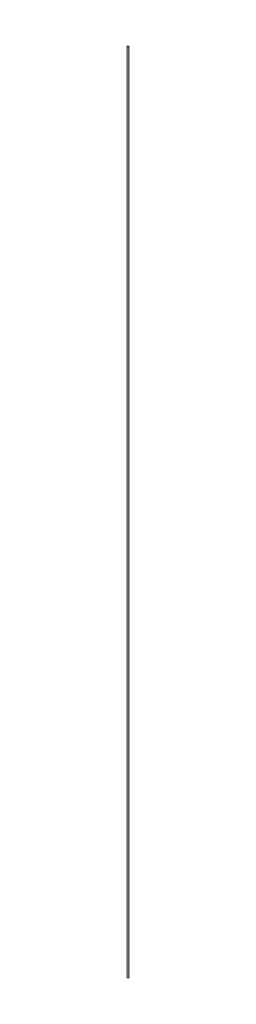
SolidWorks part; units mm, degrees
ref_plane "Plan de face" through (0, 0, 0) normal (0, 0, 1) x (1, 0, 0)
ref_plane "Plan de dessus" through (0, 0, 0) normal (0, 1, 0) x (1, 0, 0)
ref_plane "Plan de droite" through (0, 0, 0) normal (1, 0, 0) x (0, 0, -1)
sketch "Esquisse1" plane through (0, 0, 0) normal (0, 1, 0) x (1, 0, 0)
  circle A0 centre (0, 0) radius 1.25
  dimension "D1" = 2.5
extrude "Extrusion1" add sketch "Esquisse1" along normal blind 1480
